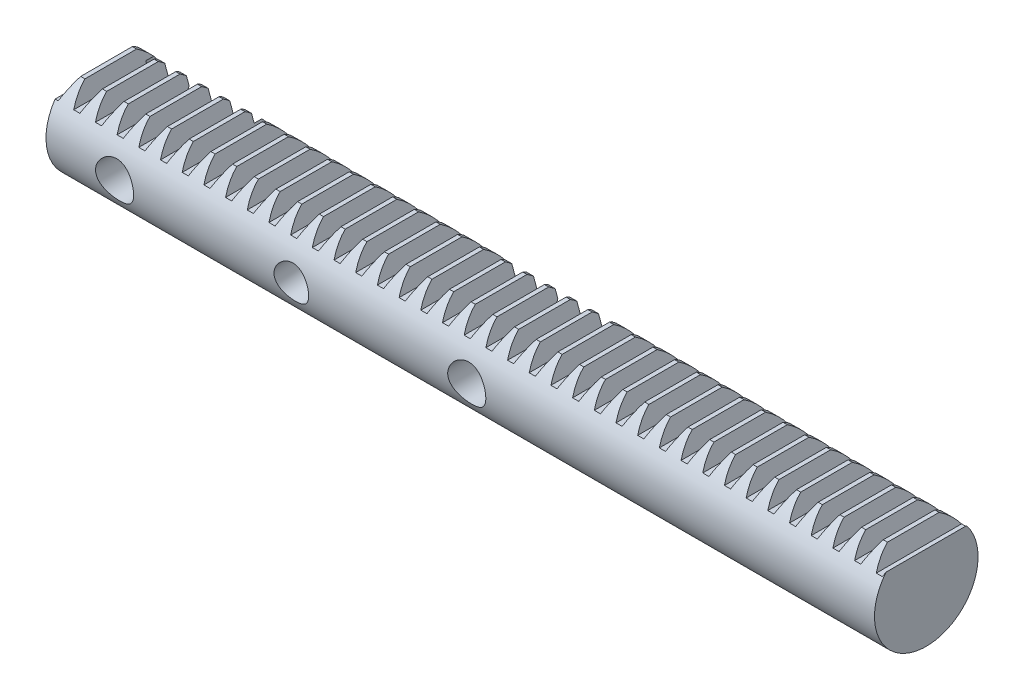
SolidWorks part; units mm, degrees
ref_plane "Plane1" through (0, 0, 0) normal (0, 0, 1) x (1, 0, 0)
ref_plane "Plane2" through (0, 0, 0) normal (0, 1, 0) x (1, 0, 0)
ref_plane "Plane3" through (0, 0, 0) normal (1, 0, 0) x (0, 0, -1)
sketch "HoldingSke" plane through (0, 0, 0) normal (0, 1, 0) x (1, 0, 0)
  line L0 (0, 0) -> (0.1392, 0.9903)
  line L1 (-15, 0) -> (100, 0) construction
  line L2 (0, 0) -> (-2.1039, 2.3779)
  line L3 (0, 0) -> (-11.863, 4.5341)
  line L4 (0, 0) -> (6.6156, 5.5511)
  line L5 (0, 0) -> (-23.7986, -8.8762)
  line L6 (0, 0) -> (-10.5278, -7.1032)
  line L9 (-71.009, 38.7566) -> (41.7541, 79.799)
  line L10 (-76.2, 3.3779) -> (-63.2, 3.3779)
  line L11 (0, 0) -> (-15, 0)
  line L12 (-76.2, 101.6) -> (-76.162, 101.6)
  line L13 (24.9733, 27.94) -> (52.9518, 28.4284)
  line L14 (24.9733, 27.94) -> (24.9743, 27.94)
  line L15 (24.9733, 27.94) -> (100.4006, 29.5858)
  circle A0 centre (0, 0) radius 19.05
  circle A1 centre (0, 0) radius 6.5
  circle A2 centre (0, 0) radius 12.7
  dimension "MPH" = 13
  dimension "Diameter" = 38.1
  dimension "Num_teeth" = 40
  dimension "Pitch" = 1
  dimension "Width" = 15
  dimension "Show_teeth" = 998
  dimension "Thickness" = 12.7
  dimension "Ap" = 20
  dimension "Pitch_height" = 13
  dimension "Backlash" = 0.038
  dimension "Addendum_fac" = 1
  dimension "Dedendum_fac" = 1.25
  dimension "Clearance_fac" = 0.25
  dimension "Dedendum_add" = 0.001
  dimension "Length" = 120
  dimension "Module" = 1
sketch "BlankSke" plane through (0, 0, 0) normal (0, 0, 1) x (1, 0, 0)
  line L1 (0, 0) -> (120, 0)
  line L2 (0, 0) -> (0, 14)
  line L3 (0, 14) -> (120, 14)
  line L4 (120, 0) -> (120, 14)
  dimension "Length" = 120
  dimension "Blank_height" = 14
extrude "Blank" add sketch "BlankSke" against normal blind 15
sketch "TooCutSkeIll" plane through (0, 0, 0) normal (0, 0, 1) x (1, 0, 0)
  line L0 (-1.2538, 13.9737) -> (-0.5045, 11.9152)
  line L1 (-0.2687, 11.75) -> (0.2687, 11.75)
  line L2 (0.5045, 11.9152) -> (1.2538, 13.9737)
  line L3 (120, 14) -> (0, 14) construction
  line L4 (0, 0) -> (0, 64.897) construction
  line L5 (-13.208, 13) -> (12.954, 13) construction
  line L6 (0, 0) -> (120, 0) construction
  line L7 (0.8994, 13) -> (0.8994, 48.7463) construction
  line L8 (-0.8994, 13) -> (-0.8994, 48.7463) construction
  line L9 (1.2914, 14) -> (1.2914, 14.0254)
  line L10 (-1.2914, 14) -> (-1.2914, 14.0254)
  line L11 (-1.2914, 14.0254) -> (1.2914, 14.0254)
  arc A0 (0.2687, 11.75) -> (0.5045, 11.9152) centre (0.2687, 12.001) ccw
  arc A1 (-0.5045, 11.9152) -> (-0.2687, 11.75) centre (-0.2687, 12.001) ccw
  arc A2 (1.2914, 14) -> (1.2538, 13.9737) centre (1.2914, 13.96) ccw
  arc A3 (-1.2538, 13.9737) -> (-1.2914, 14) centre (-1.2914, 13.96) ccw
  dimension "Root_fillet" = 0.251
  dimension "Break_rad" = 0.04
  dimension "Pitch_height" = 13
  dimension "Gap_width" = 1.7988
  dimension "Dedendum" = 1.25
  dimension "Addendum_plus" = 1.0254
  dimension "Pressure_angle" = 20
extrude "ToothCutIll" [suppressed] cut sketch "TooCutSkeIll" against normal through all
sketch "TooCutSkeSim" plane through (0, 0, 0) normal (0, 0, 1) x (1, 0, 0)
  line L0 (0.4444, 11.75) -> (-0.4444, 11.75)
  line L1 (1.2726, 14.0254) -> (0.4444, 11.75)
  line L2 (0, 17.4625) -> (0, 53.467) construction
  line L3 (1.2726, 14.0254) -> (-1.2726, 14.0254)
  line L6 (-1.2726, 14.0254) -> (-0.4444, 11.75)
  line L9 (-0.8994, 13) -> (0.8994, 13) construction
  line L10 (0, 0) -> (120, 0) construction
  line L11 (0.8994, 13) -> (0.8994, 53.467) construction
  line L12 (-0.8994, 13) -> (-0.8994, 53.467) construction
  dimension "Pitch_height" = 13
  dimension "Pressure_angle" = 20
  dimension "Gap_width" = 1.7988
  dimension "Dedendum" = 1.25
  dimension "Addendum_plus" = 1.0254
extrude "ToothCutSim" cut sketch "TooCutSkeSim" against normal through all
pattern_linear "TeethCuts" count 39 spacing 3.1416 along (1, 0, 0) of "ToothCutIll", "ToothCutSim"
sketch "Sketch1" plane through (120, 0, 0) normal (1, 0, 0) x (0, 0, -1)
  line L0 (15, 0) -> (0, 0) construction
  line L1 (15, 0) -> (15, 12.2309) construction
  circle A0 centre (7.5, 7.5) radius 7.5
  dimension "D1" = 15
extrude "Cut-Extrude1" cut sketch "Sketch1" against normal through all flip side to cut
ref_plane "Plane4" through (0, 0, -15) normal (0, 0, -1) x (-1, 0, 0)
sketch "Sketch2" plane through (0, 0, -15) normal (0, 0, -1) x (-1, 0, 0)
  line L0 (0, 0) -> (0, 11.75) construction
  line L1 (-2.45, 15) -> (-18.15, 15)
  line L2 (-2.45, 15) -> (-2.45, 0)
  line L3 (-2.45, 0) -> (-18.15, 0)
  line L4 (-18.15, 15) -> (-18.15, 0)
  line L5 (-2.45, 15) -> (-18.15, 0) construction
  line L6 (-2.45, 0) -> (-18.15, 15) construction
  line L7 (0, 7.5) -> (-57.9886, 7.5) construction
  line L8 (-52.85, 15) -> (-68.55, 15)
  line L9 (-52.85, 15) -> (-52.85, 0)
  line L10 (-52.85, 0) -> (-68.55, 0)
  line L11 (-68.55, 15) -> (-68.55, 0)
  line L12 (-52.85, 15) -> (-68.55, 0) construction
  line L13 (-52.85, 0) -> (-68.55, 15) construction
  point P0 (-10.3, 7.5)
  point P7 (-60.7, 7.5)
  dimension "D1" = 15.7
  dimension "D2" = 10.3
  dimension "D3" = 15
  dimension "D4" = 7.5
  dimension "D5" = 60.7
extrude "Cut-Extrude2" cut sketch "Sketch2" against normal blind 3
hole_wizard "CSK for M5 Hex Socket Countersunk Cap Screw1" positions "Sketch4" profile "Sketch3" countersink size "M5" standard "ISO"
sketch "Sketch4" plane through (0, 0, -12) normal (0, 0, -1) x (-1, 0, 0)
  point P0 (-9.9117, 6.963)
  point P2 (-60.9207, 6.963)
sketch "Sketch3" plane through (9.9117, 6.963, -12) normal (1, 0, 0) x (0, 1, 0)
  line L0 (0, 0) -> (0, 12)
  line L1 (0, 12) -> (2.75, 12)
  line L2 (2.75, 12) -> (2.75, 2.85)
  line L3 (2.75, 2.85) -> (5.6, 0)
  line L5 (5.6, 0) -> (0, 0)
  line L6 (-2.75, 2.85) -> (-5.6, 0) construction
  line L11 (0, -6.35) -> (0, 107.95) construction
  dimension "Thru Hole Dia." = 5.5
  dimension "Thru Hole Depth" = 12
  dimension "Near C'Sink Dia." = 11.2
  dimension "Near C'Sink Angle" = 90
ref_plane "Plane5" through (0, 0, 0) normal (0, 0, 1) x (1, 0, 0)
sketch "Sketch12" plane through (0, 0, 0) normal (0, 0, 1) x (1, 0, 0)
  line L0 (0, 6.963) -> (35.5, 6.963) construction
  line L1 (0, 11.75) -> (0, 0) construction
  dimension "D1" = 35.5
hole_wizard "Ø5.0 (5) Diameter Hole4" positions "3DSketch7" profile "Sketch13" hole size "Ø5.0" standard "ISO"
sketch3d "3DSketch7"
  point P0 (35.5, 6.963, 0)
  point P3 (35.5, 6.963, 0)
  point P5 (35.5102, 6.939, -0.021)
sketch "Sketch13" plane through (35.5102, 6.939, -0.021) normal (1, 0, 0) x (0, -0.9972, -0.0748)
  line L0 (0, 0) -> (0, 11.5022)
  line L1 (0, 11.5022) -> (2.5, 10)
  line L2 (2.5, 10) -> (2.5, 0)
  line L5 (2.5, 0) -> (0, 0)
  line L10 (0, 11.5022) -> (-2.5, 10) construction
  line L11 (0, -6.35) -> (0, 107.95) construction
  dimension "Hole Dia." = 5
  dimension "Hole Depth" = 10
  dimension "Drill Angle" = 118
equation "' \"Module@HoldingSke\" = 6.35"
equation "' \"Num_teeth@HoldingSke\" = 12"
equation "' \"Ap@HoldingSke\" =  20"
equation "' \"Width@HoldingSke\" = 0.25 * 25.4"
equation "' \"Show_teeth@HoldingSke\" = 500"
equation "' \"Backlash@HoldingSke\" = 0.009 * 25.4"
equation "' \"Addendum_fac@HoldingSke\" = 1.0"
equation "' \"Dedendum_fac@HoldingSke\" = 1.25"
equation "' \"Dedendum_add@HoldingSke\" = 0.00005 * 25.4"
equation "' \"Clearance_fac@HoldingSke\" = 0.25"
equation "' \"Pitch_height@HoldingSke\" = 1 * 25.4"
equation "' \"Length@HoldingSke\" = 4.71 * 25.4"
equation "\"Pitch@HoldingSke\" = 1 / \"Module@HoldingSke\""
equation "\"MPH@HoldingSke\" = \"Dedendum_fac@HoldingSke\" / \"Pitch@HoldingSke\" + 2 * \"Dedendum_add@HoldingSke\" + 0.002 * 25.4"
equation "\"MPH@HoldingSke\" = ((sgn( \"MPH@HoldingSke\" - \"Pitch_height@HoldingSke\")+1)*( \"MPH@HoldingSke\" - \"Pitch_height@HoldingSke\"))/2 + \"Pitch_height@HoldingSke\""
equation "\"Blank_height@BlankSke\" = \"Pitch_height@HoldingSke\" + \"Addendum_fac@HoldingSke\"  / \"Pitch@HoldingSke\" "
equation "\"Length@BlankSke\" =  \"Length@HoldingSke\""
equation "\"Face_width@Blank\" = \"Width@HoldingSke\""
equation "\"Pressure_angle@TooCutSkeIll\" = \"Ap@HoldingSke\""
equation "\"Addendum_plus@TooCutSkeIll\" =  \"Addendum_fac@HoldingSke\"  / \"Pitch@HoldingSke\" + 0.001 *25.4"
equation "\"Dedendum@TooCutSkeIll\" = \"Dedendum_fac@HoldingSke\"  / \"Pitch@HoldingSke\""
equation "\"Pitch_height@TooCutSkeIll\" =  \"MPH@HoldingSke\""
equation "\"Gap_width@TooCutSkeIll\" = 3.14159265 / 2 / \"Pitch@HoldingSke\" + 6 * \"Backlash@HoldingSke\""
equation "\"Pressure_angle@TooCutSkeSim\" = \"Ap@HoldingSke\""
equation "\"Addendum_plus@TooCutSkeSim\" =  \"Addendum_fac@HoldingSke\"  / \"Pitch@HoldingSke\" + 0.001 * 25.4"
equation "\"Dedendum@TooCutSkeSim\" = \"Dedendum_fac@HoldingSke\"  / \"Pitch@HoldingSke\""
equation "\"Pitch_height@TooCutSkeSim\" =  \"MPH@HoldingSke\""
equation "\"Gap_width@TooCutSkeSim\" = 3.14159265 / 2 / \"Pitch@HoldingSke\" + 6 * \"Backlash@HoldingSke\""
equation "\"Root_fillet@TooCutSkeIll\" = \"Clearance_fac@HoldingSke\" / \"Pitch@HoldingSke\" + \"Dedendum_add@HoldingSke\""
equation "\"Break_rad@TooCutSkeIll\" = 0.02 / \"Pitch@HoldingSke\" * 2"
equation "\"Linear_pitch@TeethCuts\" = 3.14159265 / \"Pitch@HoldingSke\""
equation "\"Num_teeth@HoldingSke\" = int( ( \"Length@HoldingSke\" + 0 ) / (3.14159265 / \"Pitch@HoldingSke\")) + 0.9999  + 1"
equation " \"Num_teeth@TeethCuts\" = int( \"Show_teeth@HoldingSke\" ) + 1"
equation " \"Num_teeth@TeethCuts\" = ((sgn( \"Num_teeth@TeethCuts\" - \"Num_teeth@HoldingSke\" )-1)*( \"Num_teeth@TeethCuts\" - \"Num_teeth@HoldingSke\" ))/-2+ \"Num_teeth@HoldingSke\""
equation " \"Num_teeth@TeethCuts\" = ((sgn( \"Num_teeth@TeethCuts\" - 2.0)+1)*( \"Num_teeth@TeethCuts\" - 2.0))/2 +2.0"
